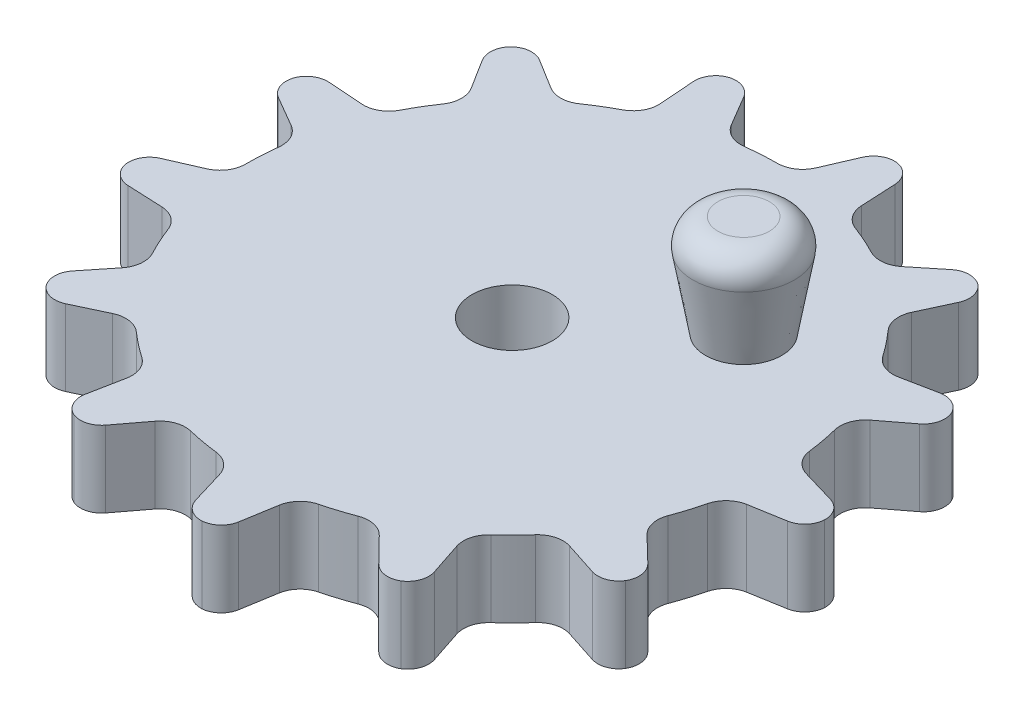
SolidWorks part; units mm, degrees
ref_plane "Front Plane" through (0, 0, 0) normal (0, 0, 1) x (1, 0, 0)
ref_plane "Top Plane" through (0, 0, 0) normal (0, 1, 0) x (1, 0, 0)
ref_plane "Right Plane" through (0, 0, 0) normal (1, 0, 0) x (0, 0, -1)
body saved out of another part "Stock-Cogs-1"
sketch "Sketch1" plane through (0, 9, 0) normal (0, 1, 0) x (1, 0, 0)
  line L0 (56.2948, 32.5063) -> (81.0389, 51.9994) construction
  arc A0 (82.1491, 50.5009) -> (79.8419, 53.4296) centre (56.2948, 32.5063) ccw construction
  circle A1 centre (71.6126, 44.5734) radius 4.5
  dimension "D1" = 9
  dimension "D2" = 12
extrude "Boss-Extrude1" add sketch "Sketch1" along normal blind 12 draft 10
fillet "Fillet1" radius 3 1 edges at (71.6126, 21, -37.9575)
